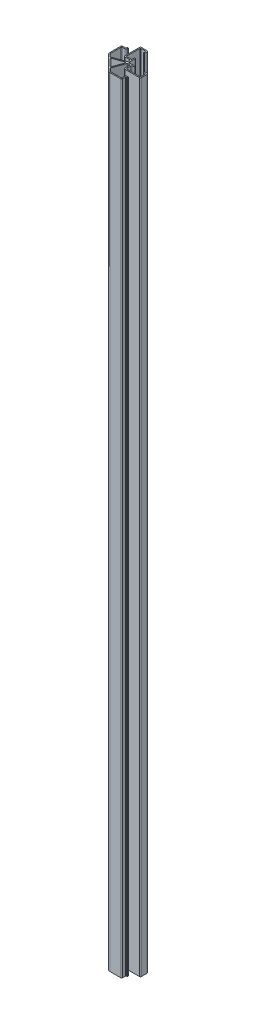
SolidWorks part; units mm, degrees
ref_plane "Plan de face" through (0, 0, 0) normal (0, 0, 1) x (1, 0, 0)
ref_plane "Plan de dessus" through (0, 0, 0) normal (0, 1, 0) x (1, 0, 0)
ref_plane "Plan de droite" through (0, 0, 0) normal (1, 0, 0) x (0, 0, -1)
sketch "Esquisse1" plane through (0, 0, 0) normal (0, 1, 0) x (1, 0, 0)
  line L0 (0, 0) -> (5.25, 0)
  line L1 (12.65, 0) -> (14.7, 0)
  line L2 (15.5, -0.8) -> (15.5, -5.3)
  line L3 (12.35, -0.3) -> (12.35, -0.55)
  line L4 (12.65, -0.85) -> (14.15, -0.85)
  line L5 (14.65, -1.35) -> (14.65, -4.75)
  line L6 (-9.8472, -3.9947) -> (-0.6456, -0.6456)
  line L7 (14.7, -6.1) -> (3.197, -6.1)
  line L8 (5.55, -0.3) -> (5.55, -0.55)
  line L9 (5.25, -0.85) -> (3.75, -0.85)
  line L10 (14.15, -5.25) -> (3.75, -5.25)
  line L11 (3.25, -1.35) -> (3.25, -4.75)
  line L12 (2.397, -5.3) -> (2.397, -1.35)
  line L13 (9.7, -10.1) -> (8.8, -10.1)
  line L14 (10, -10.4) -> (10, -10.65)
  line L15 (9.7, -10.95) -> (9.35, -10.95)
  line L16 (8.85, -13.6) -> (8.85, -11.45)
  line L17 (8.05, -14.4) -> (-0.4074, -14.4)
  line L18 (8, -13.05) -> (8, -10.9)
  line L19 (-2.5287, -13.5213) -> (-8.025, -8.025)
  line L20 (0, 0) -> (-10.8535, -10.8535) construction
  line L21 (-3.6, -3.6438) -> (-3.6, -11.2479) construction
  line L22 (7.5, -13.55) -> (-1.0908, -13.55)
  line L23 (-1.4444, -13.4036) -> (-3.3748, -11.4732)
  line L24 (-3.4911, -10.9486) -> (0.0648, -1.179)
  line L25 (0.5346, -0.85) -> (1.897, -0.85)
  line L26 (-4.8181, -10.0298) -> (-7.424, -7.424)
  line L27 (-3.9947, -9.8472) -> (-0.6456, -0.6456)
  line L28 (-10.9486, -3.4911) -> (-1.179, 0.0648)
  line L29 (-0.85, 0.5346) -> (-0.85, 1.897)
  line L30 (-13.55, 7.5) -> (-13.55, -1.0908)
  line L31 (-13.05, 8) -> (-10.9, 8)
  line L32 (-14.4, 8.05) -> (-14.4, -0.4074)
  line L33 (-13.6, 8.85) -> (-11.45, 8.85)
  line L34 (-10.95, 9.7) -> (-10.95, 9.35)
  line L35 (-10.4, 10) -> (-10.65, 10)
  line L36 (-10.1, 9.7) -> (-10.1, 8.8)
  line L37 (-5.3, 2.397) -> (-1.35, 2.397)
  line L38 (-1.35, 3.25) -> (-4.75, 3.25)
  line L39 (-5.25, 14.15) -> (-5.25, 3.75)
  line L40 (-0.85, 5.25) -> (-0.85, 3.75)
  line L41 (-0.3, 5.55) -> (-0.55, 5.55)
  line L42 (-6.1, 14.7) -> (-6.1, 3.197)
  line L43 (-1.35, 14.65) -> (-4.75, 14.65)
  line L44 (-0.85, 12.65) -> (-0.85, 14.15)
  line L45 (-0.3, 12.35) -> (-0.55, 12.35)
  line L46 (-0.8, 15.5) -> (-5.3, 15.5)
  line L47 (0, 12.65) -> (0, 14.7)
  line L48 (0, 0) -> (0, 5.25)
  line L49 (-13.5213, -2.5287) -> (-8.025, -8.025)
  line L50 (-7.424, -7.424) -> (-10.0298, -4.8181)
  line L51 (-11.4732, -3.3748) -> (-13.4036, -1.4444)
  arc A0 (-4.8181, -10.0298) -> (-3.9947, -9.8472) centre (-4.4646, -9.6762) ccw
  arc A1 (-3.3748, -11.4732) -> (-3.4911, -10.9486) centre (-3.0212, -11.1196) cw
  arc A2 (0.5346, -0.85) -> (0.0648, -1.179) centre (0.5346, -1.35) ccw
  arc A3 (-1.4444, -13.4036) -> (-1.0908, -13.55) centre (-1.0908, -13.05) ccw
  arc A4 (1.897, -0.85) -> (2.397, -1.35) centre (1.897, -1.35) cw
  arc A5 (3.75, -0.85) -> (3.25, -1.35) centre (3.75, -1.35) ccw
  arc A6 (14.15, -0.85) -> (14.65, -1.35) centre (14.15, -1.35) cw
  arc A7 (14.65, -4.75) -> (14.15, -5.25) centre (14.15, -4.75) cw
  arc A8 (3.75, -5.25) -> (3.25, -4.75) centre (3.75, -4.75) cw
  arc A9 (12.65, 0) -> (12.35, -0.3) centre (12.65, -0.3) ccw
  arc A10 (12.35, -0.55) -> (12.65, -0.85) centre (12.65, -0.55) ccw
  arc A11 (5.25, 0) -> (5.55, -0.3) centre (5.25, -0.3) cw
  arc A12 (5.55, -0.55) -> (5.25, -0.85) centre (5.25, -0.55) cw
  arc A13 (2.397, -5.3) -> (3.197, -6.1) centre (3.197, -5.3) ccw
  arc A14 (14.7, -6.1) -> (15.5, -5.3) centre (14.7, -5.3) ccw
  arc A15 (15.5, -0.8) -> (14.7, 0) centre (14.7, -0.8) ccw
  arc A16 (8.05, -14.4) -> (8.85, -13.6) centre (8.05, -13.6) ccw
  arc A17 (8, -10.9) -> (8.8, -10.1) centre (8.8, -10.9) cw
  arc A18 (7.5, -13.55) -> (8, -13.05) centre (7.5, -13.05) ccw
  arc A19 (8.85, -11.45) -> (9.35, -10.95) centre (9.35, -11.45) cw
  arc A20 (9.7, -10.95) -> (10, -10.65) centre (9.7, -10.65) ccw
  arc A21 (10, -10.4) -> (9.7, -10.1) centre (9.7, -10.4) ccw
  arc A22 (-2.5287, -13.5213) -> (-0.4074, -14.4) centre (-0.4074, -11.4) ccw
  arc A23 (-11.4732, -3.3748) -> (-10.9486, -3.4911) centre (-11.1196, -3.0212) ccw
  arc A24 (-13.4036, -1.4444) -> (-13.55, -1.0908) centre (-13.05, -1.0908) cw
  arc A25 (-13.5213, -2.5287) -> (-14.4, -0.4074) centre (-11.4, -0.4074) cw
  arc A26 (-10.0298, -4.8181) -> (-9.8472, -3.9947) centre (-9.6762, -4.4646) cw
  arc A27 (-10.4, 10) -> (-10.1, 9.7) centre (-10.4, 9.7) cw
  arc A28 (-10.95, 9.7) -> (-10.65, 10) centre (-10.65, 9.7) cw
  arc A29 (-11.45, 8.85) -> (-10.95, 9.35) centre (-11.45, 9.35) ccw
  arc A30 (-13.55, 7.5) -> (-13.05, 8) centre (-13.05, 7.5) cw
  arc A31 (-10.9, 8) -> (-10.1, 8.8) centre (-10.9, 8.8) ccw
  arc A32 (-14.4, 8.05) -> (-13.6, 8.85) centre (-13.6, 8.05) cw
  arc A33 (-0.8, 15.5) -> (0, 14.7) centre (-0.8, 14.7) cw
  arc A34 (-6.1, 14.7) -> (-5.3, 15.5) centre (-5.3, 14.7) cw
  arc A35 (-5.3, 2.397) -> (-6.1, 3.197) centre (-5.3, 3.197) cw
  arc A36 (-0.55, 5.55) -> (-0.85, 5.25) centre (-0.55, 5.25) ccw
  arc A37 (0, 5.25) -> (-0.3, 5.55) centre (-0.3, 5.25) ccw
  arc A38 (-0.55, 12.35) -> (-0.85, 12.65) centre (-0.55, 12.65) cw
  arc A39 (0, 12.65) -> (-0.3, 12.35) centre (-0.3, 12.65) cw
  arc A40 (-5.25, 3.75) -> (-4.75, 3.25) centre (-4.75, 3.75) ccw
  arc A41 (-4.75, 14.65) -> (-5.25, 14.15) centre (-4.75, 14.15) ccw
  arc A42 (-0.85, 14.15) -> (-1.35, 14.65) centre (-1.35, 14.15) ccw
  arc A43 (-0.85, 3.75) -> (-1.35, 3.25) centre (-1.35, 3.75) cw
  arc A44 (-0.85, 1.897) -> (-1.35, 2.397) centre (-1.35, 1.897) ccw
  arc A45 (-0.85, 0.5346) -> (-1.179, 0.0648) centre (-1.35, 0.5346) cw
  point P44 (3.25, -0.85)
  point P54 (12.35, 0)
  point P57 (12.35, -0.85)
  point P60 (5.55, 0)
  point P63 (5.55, -0.85)
  point P68 (15.5, -6.1)
  point P71 (15.5, 0)
  point P74 (8.85, -14.4)
  point P77 (8, -10.1)
  point P84 (10, -10.95)
  point P87 (10, -10.1)
  point P90 (-1.65, -14.4)
  point P158 (-10.1, 10)
  point P159 (-10.95, 10)
  point P160 (-10.1, 8)
  point P161 (-14.4, 8.85)
  point P162 (0, 15.5)
  point P163 (-6.1, 15.5)
  point P164 (-0.85, 5.55)
  point P165 (0, 5.55)
  point P166 (-0.85, 12.35)
  point P167 (0, 12.35)
  point P168 (-0.85, 3.25)
  dimension "D26" = 0.5
  dimension "D27" = 0.5
  dimension "D28" = 0.5
  dimension "D29" = 0.5
  dimension "D30" = 0.5
  dimension "D31" = 0.5
  dimension "D32" = 0.5
  dimension "D33" = 0.3
  dimension "D34" = 0.8
  dimension "D35" = 0.8
  dimension "D36" = 0.5
  dimension "D37" = 0.3
  dimension "D38" = 3
  dimension "D1" = 3.15
  dimension "D2" = 5.55
  dimension "D3" = 6.1
  dimension "D4" = 0.85
  dimension "D5" = 0.85
  dimension "D6" = 0.85
  dimension "D7" = 0.85
  dimension "D8" = 6.8
  dimension "D9" = 0.853
  dimension "D10" = 0.85
  dimension "D11" = 4
  dimension "D12" = 14.4
  dimension "D13" = 10.5
  dimension "D14" = 45
  dimension "D15" = 13.6
  dimension "D16" = 0.85
  dimension "D17" = 0.85
  dimension "D18" = 5.5
  dimension "D19" = 0.85
  dimension "D20" = 2
  dimension "D21" = 9.0156
  dimension "D22" = 2.3
  dimension "D23" = 0.85
  dimension "D24" = 0.85
  dimension "D25" = 70
extrude "Boss.-Extru.1" add sketch "Esquisse1" along normal blind 620
fillet "Congé1" radius 0.5 1 edges at (-0.6456, 310, 0.6456)
